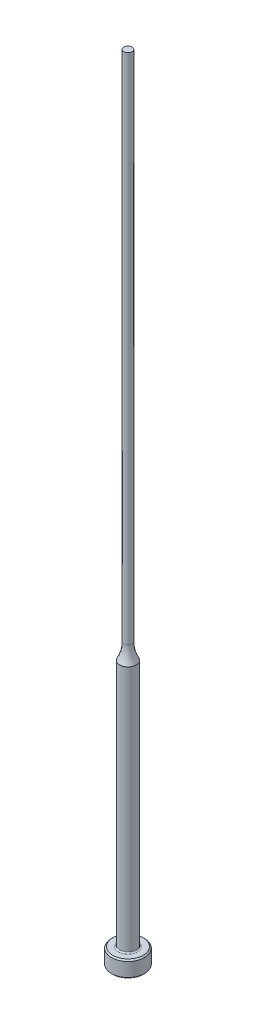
SolidWorks part; units mm, degrees
ref_plane "Front Plane" through (0, 0, 0) normal (0, 0, 1) x (1, 0, 0)
ref_plane "Top Plane" through (0, 0, 0) normal (0, 1, 0) x (1, 0, 0)
ref_plane "Right Plane" through (0, 0, 0) normal (1, 0, 0) x (0, 0, -1)
sketch "Sketch1" plane through (0, 0, 0) normal (0, 0, 1) x (1, 0, 0)
  line L0 (0, 259.9588) -> (0, -15.1925) construction
  line L1 (0, 0) -> (-3.175, 0)
  line L2 (-3.175, 0) -> (-3.175, 3.175)
  line L3 (-3.175, 3.175) -> (-1.5875, 3.175)
  line L4 (-0.7937, 53.8742) -> (-0.7937, 152.4)
  line L5 (-0.7937, 152.4) -> (0, 152.4)
  line L6 (0, 152.4) -> (0, 0)
  line L7 (-1.5875, 3.175) -> (-1.5875, 50.8)
  arc A0 (-1.5875, 50.8) -> (-0.7937, 53.8742) centre (-7.1437, 53.8742) ccw
  point P13 (-1.5875, 0)
  dimension "D1" = 6.35
  dimension "L" = 152.4
  dimension "D2" = 3.175
  dimension "H" = 6.35
  dimension "T" = 3.175
  dimension "D" = 1.5875
  dimension "S" = 50.8
revolve "Revolve1" add sketch "Sketch1" angle 360 about L0
chamfer "Chamfer1" distance 0.254 angle 45 2 edges at (0, 3.175, 3.175) (0, 0, 3.175)
fillet "Fillet1" radius 0.254 1 edges at (0, 3.175, 1.5875)
